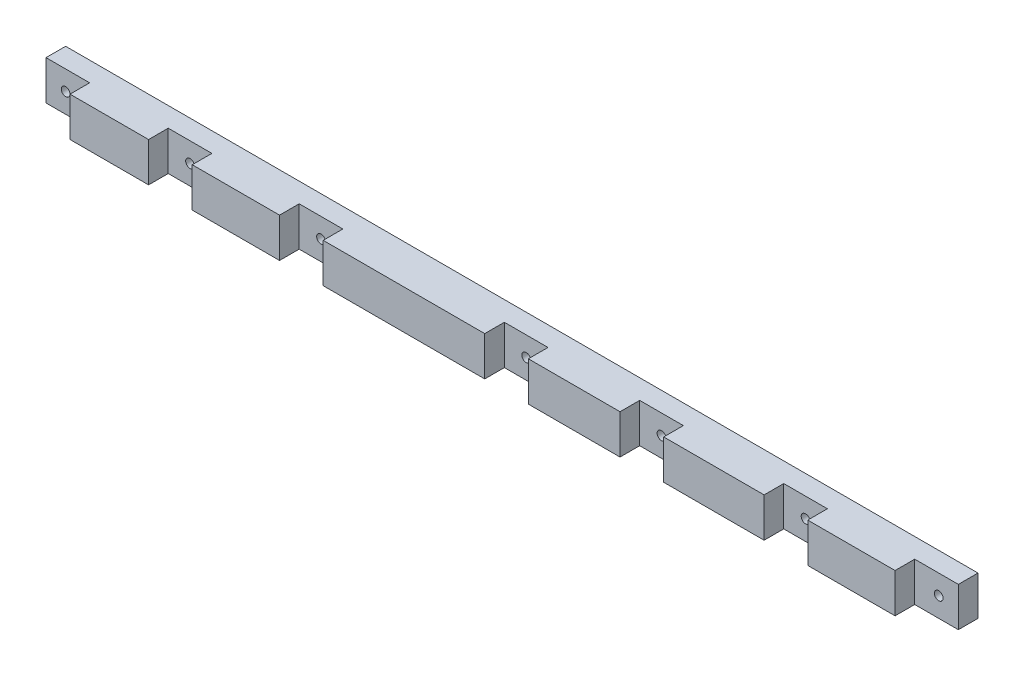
SolidWorks part; units mm, degrees
ref_plane "Plan de face" through (0, 0, 0) normal (0, 0, 1) x (1, 0, 0)
ref_plane "Plan de dessus" through (0, 0, 0) normal (0, 1, 0) x (1, 0, 0)
ref_plane "Plan de droite" through (0, 0, 0) normal (1, 0, 0) x (0, 0, -1)
sketch "Esquisse1" plane through (0, 0, 0) normal (0, 0, 1) x (1, 0, 0)
  line L1 (0, 0) -> (209, 0)
  line L2 (0, 0) -> (0, 9)
  line L3 (0, 9) -> (209, 9)
  line L4 (209, 0) -> (209, 9)
  dimension "D1" = 209
  dimension "D2" = 9
extrude "Extrusion1" add sketch "Esquisse1" along normal blind 9
sketch "Esquisse2" plane through (0, 0, 9) normal (0, 0, 1) x (1, 0, 0)
  line L0 (209, 9) -> (0, 9) construction
  line L1 (209, 0) -> (199, 0)
  line L2 (209, 0) -> (209, 9)
  line L3 (209, 9) -> (199, 9)
  line L4 (199, 0) -> (199, 9)
  dimension "D1" = 10
extrude "Enlèv. mat.-Extru.1" cut sketch "Esquisse2" against normal blind 4.5
sketch "Esquisse4" plane through (0, 0, 4.5) normal (0, 0, 1) x (1, 0, 0)
  line L0 (209, 0) -> (209, 9) construction
  line L1 (209, 9) -> (199, 9) construction
  circle A0 centre (204.5, 4.5) radius 1
  dimension "D3" = 2
  dimension "D1" = 4.5
  dimension "D2" = 4.5
extrude "Enlèv. mat.-Extru.2" cut sketch "Esquisse4" against normal blind 4.5
sketch "Esquisse5" plane through (0, 0, 9) normal (0, 0, 1) x (1, 0, 0)
  line L0 (199, 9) -> (0, 9) construction
  line L1 (0, 0) -> (10, 0)
  line L2 (0, 0) -> (0, 9)
  line L3 (0, 9) -> (10, 9)
  line L4 (10, 0) -> (10, 9)
  dimension "D1" = 10
extrude "Enlèv. mat.-Extru.3" cut sketch "Esquisse5" against normal blind 4.5
sketch "Esquisse6" plane through (0, 0, 9) normal (0, 0, 1) x (1, 0, 0)
  line L0 (10, 0) -> (199, 0) construction
  line L1 (28, 0) -> (38, 0)
  line L2 (28, 0) -> (28, 9)
  line L3 (28, 9) -> (38, 9)
  line L4 (38, 0) -> (38, 9)
  line L5 (199, 9) -> (10, 9) construction
  dimension "D1" = 10
  dimension "D2" = 18
extrude "Enlèv. mat.-Extru.4" cut sketch "Esquisse6" against normal blind 4.5
sketch "Esquisse7" plane through (0, 0, 9) normal (0, 0, 1) x (1, 0, 0)
  line L0 (38, 0) -> (199, 0) construction
  line L1 (58, 0) -> (68, 0)
  line L2 (58, 0) -> (58, 9)
  line L3 (58, 9) -> (68, 9)
  line L4 (68, 0) -> (68, 9)
  line L5 (199, 9) -> (38, 9) construction
  dimension "D1" = 10
  dimension "D2" = 20
extrude "Enlèv. mat.-Extru.5" cut sketch "Esquisse7" against normal blind 4.5
sketch "Esquisse8" plane through (0, 0, 9) normal (0, 0, 1) x (1, 0, 0)
  line L0 (68, 0) -> (199, 0) construction
  line L1 (105, 0) -> (115, 0)
  line L2 (105, 0) -> (105, 9)
  line L3 (105, 9) -> (115, 9)
  line L4 (115, 0) -> (115, 9)
  line L5 (199, 9) -> (68, 9) construction
  dimension "D1" = 10
  dimension "D2" = 37
extrude "Enlèv. mat.-Extru.6" cut sketch "Esquisse8" against normal blind 4.5
sketch "Esquisse9" plane through (0, 0, 9) normal (0, 0, 1) x (1, 0, 0)
  line L0 (115, 0) -> (199, 0) construction
  line L1 (136, 0) -> (146, 0)
  line L2 (136, 0) -> (136, 9)
  line L3 (136, 9) -> (146, 9)
  line L4 (146, 0) -> (146, 9)
  line L5 (199, 9) -> (115, 9) construction
  dimension "D1" = 10
  dimension "D2" = 21
extrude "Enlèv. mat.-Extru.7" cut sketch "Esquisse9" against normal blind 4.5
sketch "Esquisse10" plane through (0, 0, 9) normal (0, 0, 1) x (1, 0, 0)
  line L0 (146, 0) -> (199, 0) construction
  line L1 (169, 0) -> (179, 0)
  line L2 (169, 0) -> (169, 9)
  line L3 (169, 9) -> (179, 9)
  line L4 (179, 0) -> (179, 9)
  line L5 (199, 9) -> (146, 9) construction
  dimension "D1" = 10
  dimension "D2" = 23
extrude "Enlèv. mat.-Extru.8" cut sketch "Esquisse10" against normal blind 4.5
sketch "Esquisse11" plane through (0, 0, 4.5) normal (0, 0, 1) x (1, 0, 0)
  line L0 (0, 0) -> (10, 0) construction
  line L1 (0, 9) -> (0, 0) construction
  circle A0 centre (4.5, 4.5) radius 1
  dimension "D3" = 2
  dimension "D1" = 4.5
  dimension "D2" = 4.5
extrude "Enlèv. mat.-Extru.9" cut sketch "Esquisse11" against normal blind 4.5
sketch "Esquisse12" plane through (0, 0, 4.5) normal (0, 0, 1) x (1, 0, 0)
  line L0 (28, 0) -> (38, 9) construction
  line L1 (38, 9) -> (28, 9) construction
  line L2 (28, 9) -> (38, 0) construction
  circle A0 centre (33, 4.5) radius 1
  dimension "D1" = 2
extrude "Enlèv. mat.-Extru.10" cut sketch "Esquisse12" against normal blind 4.5
sketch "Esquisse13" plane through (0, 0, 4.5) normal (0, 0, 1) x (1, 0, 0)
  line L0 (58, 0) -> (68, 9) construction
  line L1 (68, 9) -> (58, 9) construction
  line L2 (58, 9) -> (68, 0) construction
  circle A0 centre (63, 4.5) radius 1
  dimension "D1" = 2
extrude "Enlèv. mat.-Extru.11" cut sketch "Esquisse13" against normal blind 4.5
sketch "Esquisse14" plane through (0, 0, 4.5) normal (0, 0, 1) x (1, 0, 0)
  line L0 (115, 0) -> (105, 9) construction
  line L1 (105, 9) -> (115, 9) construction
  line L2 (115, 9) -> (105, 0) construction
  circle A0 centre (110, 4.5) radius 1
  dimension "D1" = 2
extrude "Enlèv. mat.-Extru.12" cut sketch "Esquisse14" against normal blind 4.5
sketch "Esquisse15" plane through (0, 0, 4.5) normal (0, 0, 1) x (1, 0, 0)
  line L0 (146, 0) -> (136, 9) construction
  line L1 (136, 9) -> (146, 9) construction
  line L2 (146, 9) -> (136, 0) construction
  circle A0 centre (141, 4.5) radius 1
  dimension "D1" = 2
extrude "Enlèv. mat.-Extru.13" cut sketch "Esquisse15" against normal blind 4.5
sketch "Esquisse16" plane through (0, 0, 4.5) normal (0, 0, 1) x (1, 0, 0)
  line L0 (169, 0) -> (179, 9) construction
  line L1 (179, 9) -> (179, 0) construction
  line L2 (179, 0) -> (169, 9) construction
  circle A0 centre (174, 4.5) radius 1
  dimension "D1" = 2
extrude "Enlèv. mat.-Extru.14" cut sketch "Esquisse16" against normal blind 4.5
